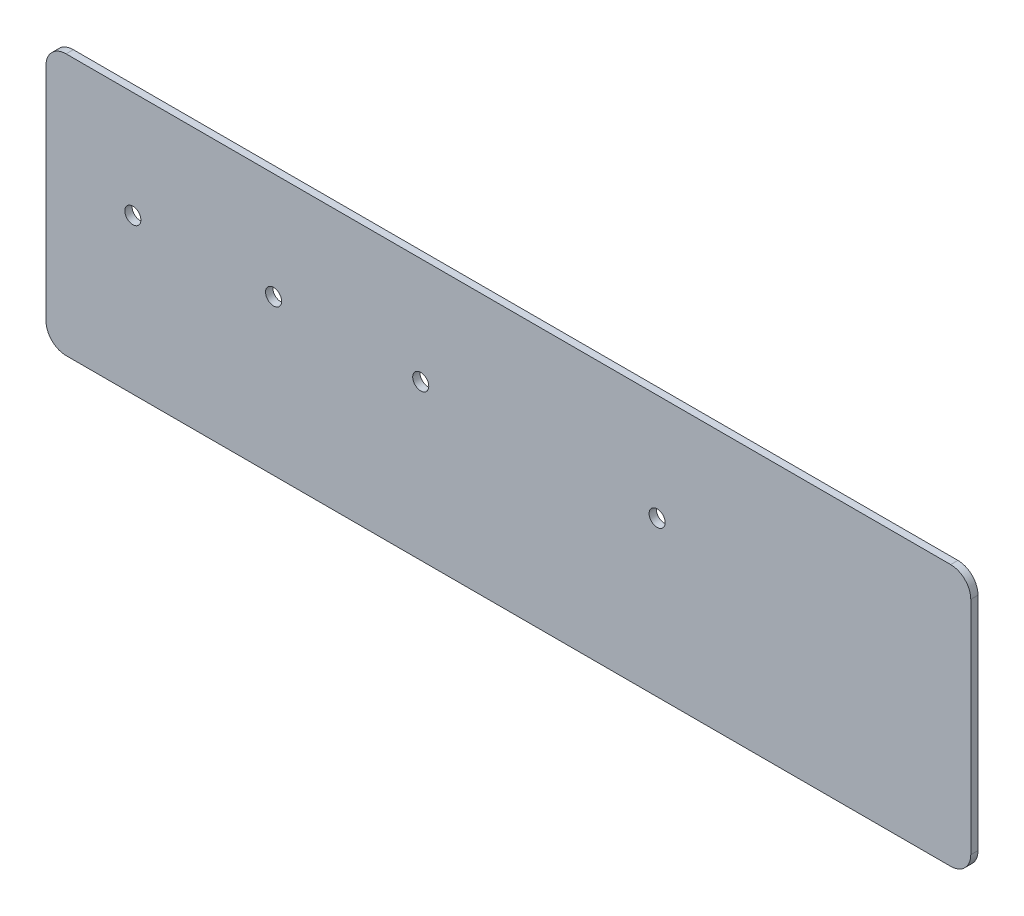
SolidWorks part; units mm, degrees
ref_plane "Front Plane" through (0, 0, 0) normal (0, 0, 1) x (1, 0, 0)
ref_plane "Top Plane" through (0, 0, 0) normal (0, 1, 0) x (1, 0, 0)
ref_plane "Right Plane" through (0, 0, 0) normal (1, 0, 0) x (0, 0, -1)
sketch "Sketch1" plane through (0, 0, 0) normal (0, 0, 1) x (1, 0, 0)
  line L1 (0, 0) -> (292.1, 0)
  line L2 (0, 0) -> (0, 82.55)
  line L3 (0, 82.55) -> (292.1, 82.55)
  line L4 (292.1, 0) -> (292.1, 82.55)
  circle A0 centre (27.432, 48.895) radius 2.54
  circle A1 centre (71.882, 48.895) radius 2.54
  circle A2 centre (118.364, 48.895) radius 2.54
  circle A3 centre (193.04, 48.895) radius 2.54
  point P13 (0, 41.275)
  dimension "D3" = 5.08
  dimension "D1" = 82.55
  dimension "D2" = 292.1
  dimension "D4" = 44.45
  dimension "D5" = 46.482
  dimension "D6" = 165.608
  dimension "D7" = 27.432
  dimension "D8" = 7.62
base flange "Base-Flange1" sketch "Sketch1" thickness 2.286 reverse thickness direction no parameters "D1"=2.286
fillet "Fillet1" radius 6.35 4 edges at (0, 0, -1.143) (0, 82.55, -1.143) (292.1, 82.55, -1.143) (292.1, 0, -1.143)
sketch "Bend-Lines1" [suppressed] plane through (0, 0, 0) normal (0, 1, 0) x (1, 0, 0)
sketch "Bounding-Box1" [suppressed] plane through (0, 0, 0) normal (0, 1, 0) x (1, 0, 0)
sheet metal parameters "Sheet-Metal1" thickness 2.286 parameters "D1"=2.286
flat pattern "Flat-Pattern1"
sketch "Bend-Lines2" plane through (0, 0, 0) normal (0, 1, 0) x (1, 0, 0)
sketch3d "Bounding-Box2" [suppressed]
  line L0 (0, 82.55, 0) -> (292.1, 82.55, 0) construction
  line L1 (0, 0, 0) -> (292.1, 0, 0) construction
  line L2 (0, 82.55, 0) -> (0, 0, 0) construction
  line L3 (292.1, 82.55, 0) -> (292.1, 0, 0) construction
